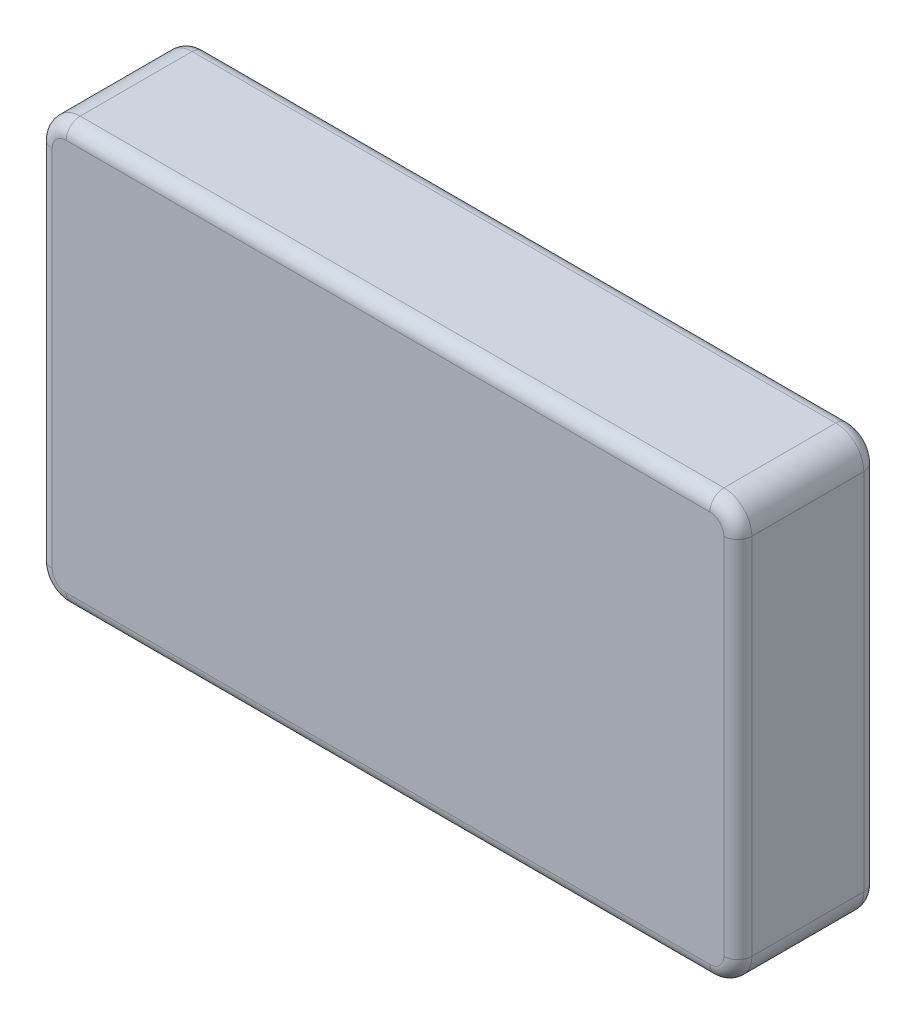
SolidWorks part; units mm, degrees
ref_plane "Front Plane" through (0, 0, 0) normal (0, 0, 1) x (1, 0, 0)
ref_plane "Top Plane" through (0, 0, 0) normal (0, 1, 0) x (1, 0, 0)
ref_plane "Right Plane" through (0, 0, 0) normal (1, 0, 0) x (0, 0, -1)
sketch "Sketch1" plane through (0, 0, 0) normal (0, 0, 1) x (1, 0, 0)
  line L1 (-21.0962, 27.2786) -> (42.4038, 27.2786)
  line L2 (-21.0962, 27.2786) -> (-21.0962, -10.8214)
  line L3 (-21.0962, -10.8214) -> (42.4038, -10.8214)
  line L4 (42.4038, 27.2786) -> (42.4038, -10.8214)
  dimension "D1" = 38.1
  dimension "D2" = 63.5
extrude "Extrude1" add sketch "Sketch1" along normal blind 12.7
fillet "Fillet1" radius 2.54 4 edges at (-21.0962, -10.8214, 6.35) (42.4038, -10.8214, 6.35) (-21.0962, 27.2786, 6.35) (42.4038, 27.2786, 6.35)
sketch "Sketch2" plane through (0, 0, 12.7) normal (0, 0, 1) x (1, 0, 0)
  text T0 "Lithium Polymer  11.4V"
fillet "Fillet2" radius 1.27 16 edges at (41.6598, 26.5347, 12.7) (42.4038, 8.2286, 12.7) (41.6598, -10.0774, 12.7) (-20.3523, -10.0774, 12.7) (-21.0962, 8.2286, 12.7) (-20.3523, 26.5347, 12.7) (41.6598, 26.5347, 0) (42.4038, 8.2286, 0) (41.6598, -10.0774, 0) (-20.3523, -10.0774, 0) (-21.0962, 8.2286, 0) (-20.3523, 26.5347, 0) (10.6538, -10.8214, 0) (10.6538, -10.8214, 12.7) (10.6538, 27.2786, 12.7) (10.6538, 27.2786, 0)
